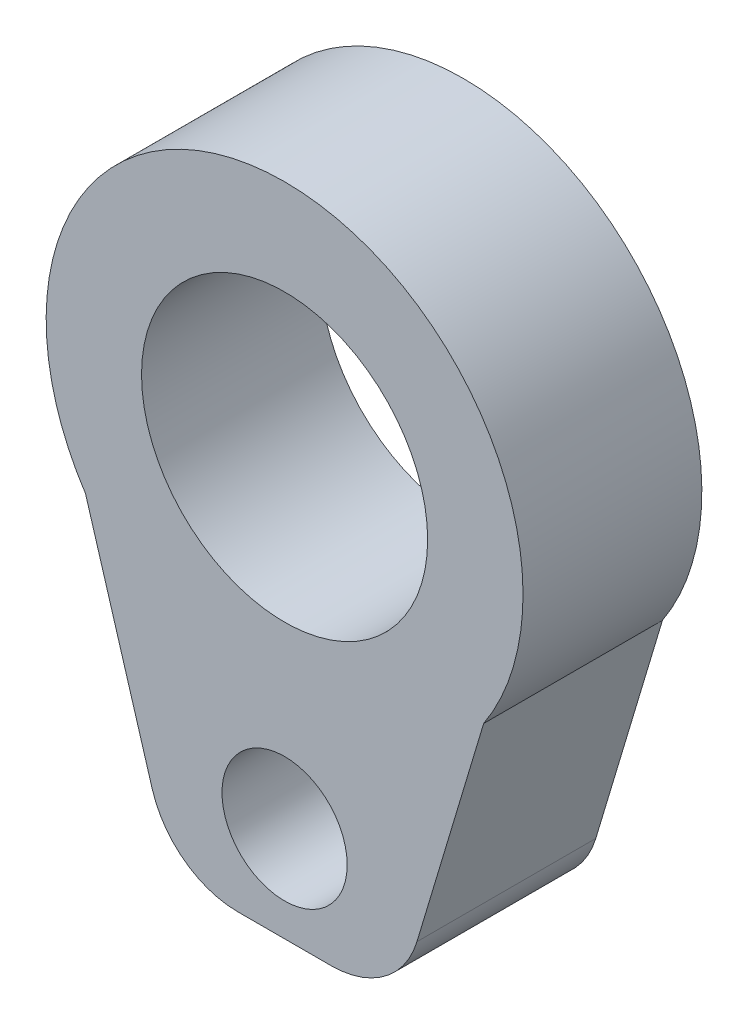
SolidWorks part; units mm, degrees
ref_plane "Ebene vorne" through (0, 0, 0) normal (0, 0, 1) x (1, 0, 0)
ref_plane "Ebene oben" through (0, 0, 0) normal (0, 1, 0) x (1, 0, 0)
ref_plane "Ebene rechts" through (0, 0, 0) normal (1, 0, 0) x (0, 0, -1)
sketch "Skizze1" plane through (0, 0, 0) normal (0, 0, 1) x (1, 0, 0)
  circle A0 centre (0, 0) radius 4
  dimension "D1" = 8
extrude "Aufsatz-Linear austragen1" add sketch "Skizze1" along normal blind 3
sketch "Skizze2" plane through (0, 0, 0) normal (0, 0, -1) x (-1, 0, 0)
  line L0 (1.65, 0) -> (-1.65, 0) construction
  line L1 (-4, 0) -> (4, 0)
  line L3 (-1.9, -7) -> (1.9, -7)
  line L5 (0, 1.65) -> (0, -1.65) construction
  line L6 (-4, 0) -> (-1.9, -7)
  line L7 (1.9, -7) -> (4, 0)
  circle A1 centre (0, 0) radius 4 construction
  point P10 (0, -7)
  dimension "D1" = 7
  dimension "D2" = 3.8
extrude "Aufsatz-Linear austragen2" add sketch "Skizze2" against normal up to surface (3 mm away)
sketch "Skizze3" plane through (0, 0, 0) normal (0, 0, -1) x (-1, 0, 0)
  circle A0 centre (0, 0) radius 2.4
  dimension "D1" = 4.8
extrude "Schnitt-Linear austragen1" cut sketch "Skizze3" against normal up to surface (3 mm away)
fillet "Verrundung1" radius 1.5 2 edges at (-1.9, -7, 1.5) (1.9, -7, 1.5)
sketch "Skizze4" plane through (0, 0, 3) normal (0, 0, 1) x (1, 0, 0)
  line L0 (0.784, -7) -> (-0.784, -7) construction
  circle A0 centre (0, -5.4) radius 1.05
  dimension "D1" = 2.1
  dimension "D2" = 1.6
extrude "Schnitt-Linear austragen2" cut sketch "Skizze4" against normal up to surface (3 mm away) contours A0
